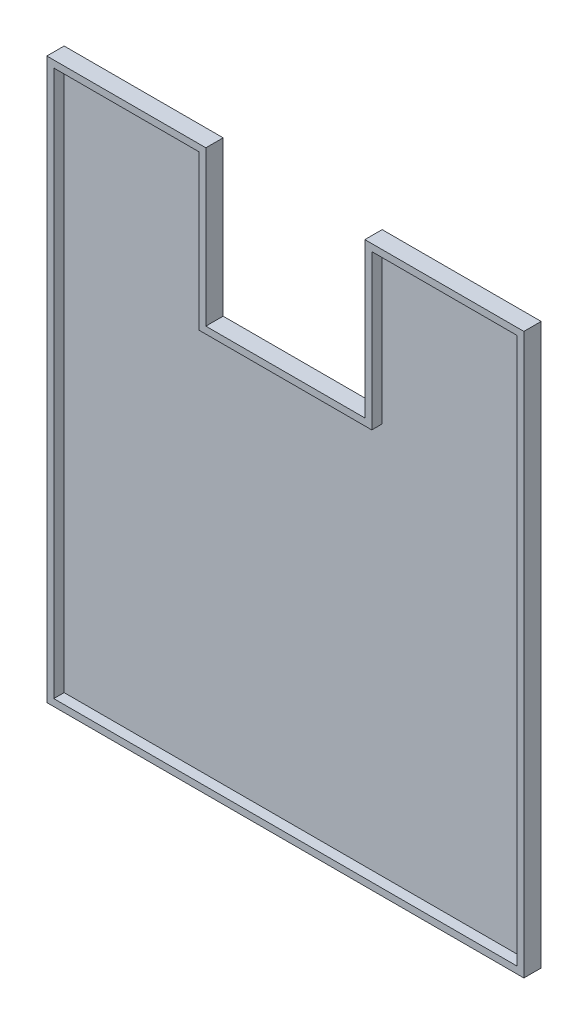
SolidWorks part; units mm, degrees
ref_plane "Front Plane" through (0, 0, 0) normal (0, 0, 1) x (1, 0, 0)
ref_plane "Top Plane" through (0, 0, 0) normal (0, 1, 0) x (1, 0, 0)
ref_plane "Right Plane" through (0, 0, 0) normal (1, 0, 0) x (0, 0, -1)
sketch "Sketch1" plane through (0, 0, 0) normal (0, 0, 1) x (1, 0, 0)
  line L0 (-25, 79) -> (-25, 34.5103)
  line L1 (-67, -79) -> (67, -79)
  line L2 (-67, -79) -> (-67, 79)
  line L3 (-67, 79) -> (-25, 79)
  line L4 (67, -79) -> (67, 79)
  line L5 (-67, -79) -> (67, 79) construction
  line L6 (-67, 79) -> (67, -79) construction
  line L7 (-25, 34.5103) -> (25, 34.5103)
  line L8 (25, 34.5103) -> (25, 79)
  line L9 (25, 79) -> (67, 79)
  point P0 (0, 0)
  dimension "D1" = 134
  dimension "D2" = 158
  dimension "D3" = 42
  dimension "D4" = 42
  dimension "D5" = 50
extrude "Boss-Extrude1" add sketch "Sketch1" along normal blind 2
sketch "Sketch3" plane through (0, 0, 2) normal (0, 0, 1) x (1, 0, 0)
  line L0 (-25, 79) -> (-67, 79)
  line L1 (-27, 81) -> (-69, 81)
  line L2 (-69, 81) -> (-69, -81)
  line L3 (-69, -81) -> (69, -81)
  line L4 (69, -81) -> (69, 81)
  line L5 (69, 81) -> (23, 81)
  line L6 (23, 81) -> (23, 36.3119)
  line L7 (23, 36.3119) -> (-23, 36.3119)
  line L8 (-23, 36.3119) -> (-23, 81)
  line L10 (-67, 79) -> (-67, -79)
  line L11 (-67, -79) -> (67, -79)
  line L12 (67, -79) -> (67, 79)
  line L13 (67, 79) -> (25, 79)
  line L14 (25, 79) -> (25, 34.5103)
  line L16 (-25, 34.5103) -> (-25, 79)
  line L17 (-23, 81) -> (-27, 81)
  line L18 (-25, 34.5103) -> (-25, 34.3119)
  line L19 (-25, 34.3119) -> (25, 34.3119)
  line L20 (25, 34.3119) -> (25, 34.5103)
  dimension "D1" = 2
  dimension "D2" = 2
  dimension "D3" = 2
  dimension "D4" = 2
  dimension "D5" = 2
  dimension "D6" = 2
  dimension "D7" = 2
extrude "Boss-Extrude2" add sketch "Sketch3" along normal blind 3 and the other way blind 2
